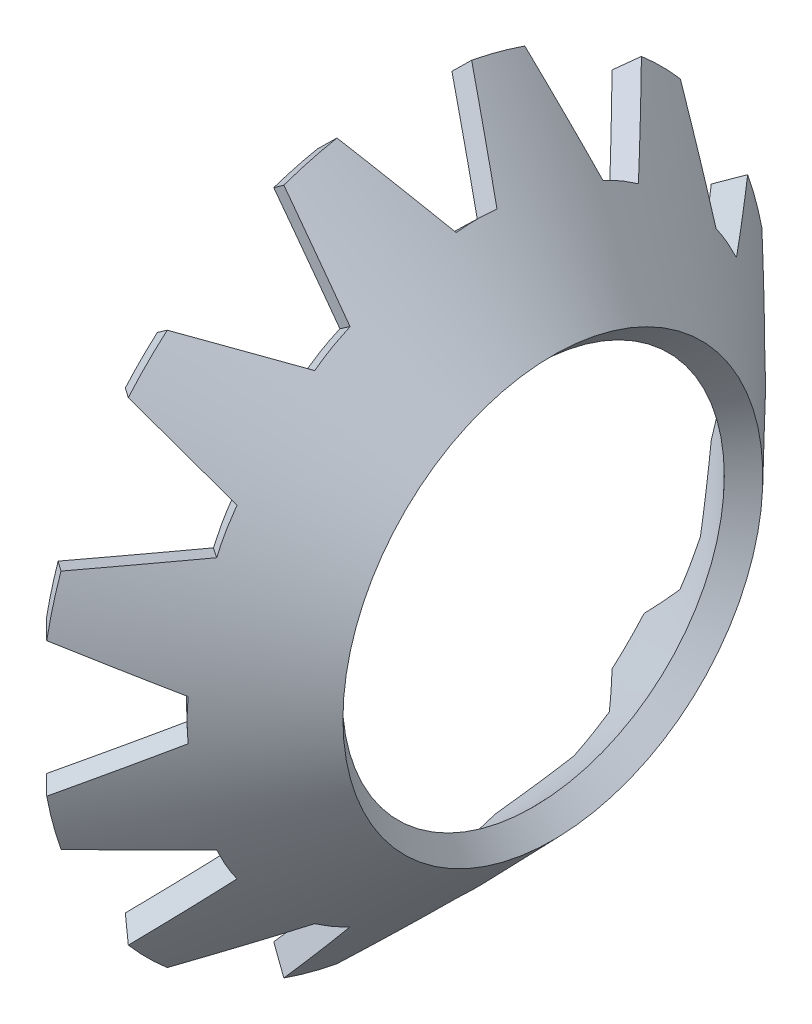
SolidWorks part; units mm, degrees
ref_plane "Plane1" through (0, 0, 0) normal (0, 0, 1) x (1, 0, 0)
ref_plane "Plane2" through (0, 0, 0) normal (0, 1, 0) x (1, 0, 0)
ref_plane "Plane3" through (0, 0, 0) normal (1, 0, 0) x (0, 0, -1)
sketch "SecSke" plane through (0, 0, 0) normal (0, 0, 1) x (1, 0, 0)
  line L0 (-34.925, 0) -> (9.525, 0) construction
  line L1 (-4.4584, 4.6168) -> (-7.7255, 8)
  line L3 (-8.1571, 7.5832) -> (-4.89, 4.2)
  line L4 (-4.89, 4.2) -> (-4.4584, 4.6168)
  line L5 (-8.1571, 7.5832) -> (-7.7255, 8)
  dimension "D1" = 46
  dimension "D2" = 4.7032
  dimension "Thickness" = 0.6
  dimension "Inside_dia" = 8.4
  dimension "Outside_dia" = 16
revolve "Base-Revolve" add sketch "SecSke" angle 360 about L0
ref_plane "CutPln" through (-7.7255, 8, 0) normal (0.7193, 0.6947, 0) x (0, 0, 1)
sketch "ExtCutSke" plane through (-7.7255, 8, 0) normal (0.7193, 0.6947, 0) x (0, 0, 1)
  line L1 (0, -13.1396) -> (0, 17.7379) construction
  line L2 (0, 0) -> (0, 8) construction
  line L3 (-0.4488, 2.2976) -> (-1.6388, -0.2386)
  line L4 (0.4488, 2.2976) -> (1.6388, -0.2386)
  arc A0 (-0.4488, 2.2976) -> (0.4488, 2.2976) centre (0, 8) ccw
  arc A1 (-1.6388, -0.2386) -> (1.6388, -0.2386) centre (0, 8) ccw
  ellipse E1 centre (0, 5.7547) end of major axis (-8, 5.7547) minor radius 5.7547 construction
  dimension "Clr_dia" = 16.8
  dimension "Cut_dia" = 11.44
  dimension "Cone_side" = 8
  dimension "Cut_ang" = 9
  dimension "Clr_ang" = 22.5
extrude "ExtCut" cut sketch "ExtCutSke" against normal through all
pattern_circular "ExtCuts" count 12 every 30 about axis through (-34.925, 0, 0) along (1, 0, 0) of "ExtCut"
equation "' \"Inside_dia@SecSke\" = 8.4"
equation "' \"Outside_dia@SecSke\" = 16"
equation "' \"Thickness@SecSke\" = 0.6"
equation "' \"Count@ExtCuts\" = 12"
equation "' \"Inside_dia@SecSke\" = 3.2"
equation "' \"Outside_dia@SecSke\" = 6"
equation "' \"Thickness@SecSke\" = 0.4"
equation "' \"Count@ExtCuts\" = 8"
equation " \"Cone_side@ExtCutSke\" = \"Outside_dia@SecSke\" / 2.0"
equation " \"Angle@ExtCuts\" = 360 / \"Count@ExtCuts\""
equation " \"Clr_dia@ExtCutSke\" =  \"Outside_dia@SecSke\" * 1.05"
equation " \"Cut_dia@ExtCutSke\" = \"Outside_dia@SecSke\" - (\"Outside_dia@SecSke\"  - \"Inside_dia@SecSke\" ) * 0.6"
equation " \"Clr_ang@ExtCutSke\" = (360 / \"Count@ExtCuts\") * 0.75"
equation " \"Cut_ang@ExtCutSke\" = (360 / \"Count@ExtCuts\") * 0.3"
